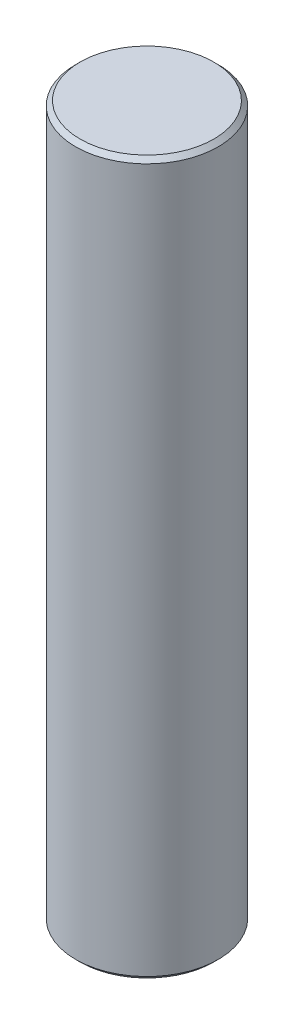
SolidWorks part; units mm, degrees
ref_plane "Plan de face" through (0, 0, 0) normal (0, 0, 1) x (1, 0, 0)
ref_plane "Plan de dessus" through (0, 0, 0) normal (0, 1, 0) x (1, 0, 0)
ref_plane "Plan de droite" through (0, 0, 0) normal (1, 0, 0) x (0, 0, -1)
sketch "Esquisse1" plane through (0, 0, 0) normal (0, 1, 0) x (1, 0, 0)
  circle A0 centre (0, 0) radius 8
  dimension "D1" = 16
extrude "Extrusion1" add sketch "Esquisse1" along normal blind 80
chamfer "Chanfrein1" distance 0.5 angle 45 2 edges at (0, 0, 8) (0, 80, 8)
